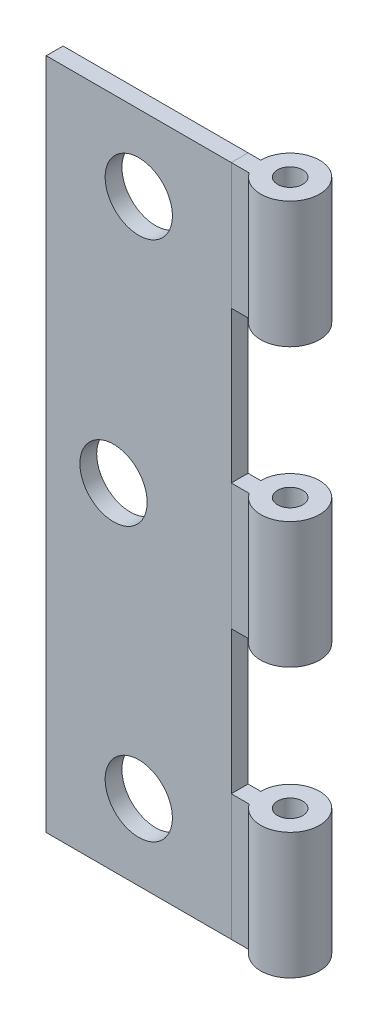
SolidWorks part; units mm, degrees
ref_plane "Front Plane" through (0, 0, 0) normal (0, 0, 1) x (1, 0, 0)
ref_plane "Top Plane" through (0, 0, 0) normal (0, 1, 0) x (1, 0, 0)
ref_plane "Right Plane" through (0, 0, 0) normal (1, 0, 0) x (0, 0, -1)
sketch "Sketch1" plane through (0, 0, 0) normal (0, 0, 1) x (1, 0, 0)
  line L1 (-8.7312, -31.75) -> (8.7313, -31.75)
  line L2 (-8.7312, -31.75) -> (-8.7312, 31.75)
  line L3 (-8.7312, 31.75) -> (8.7313, 31.75)
  line L4 (8.7313, -31.75) -> (8.7313, 31.75)
  line L5 (-8.7312, -31.75) -> (8.7313, 31.75) construction
  line L6 (-8.7312, 31.75) -> (8.7313, -31.75) construction
  point P0 (0, 0)
  dimension "D1" = 17.4625
  dimension "D2" = 63.5
extrude "Boss-Extrude1" add sketch "Sketch1" against normal blind 1.5875
sketch "Sketch3" plane through (0, 31.75, 0) normal (0, 1, 0) x (1, 0, 0)
  line L0 (-8.7312, 1.5875) -> (8.7313, 1.5875) construction
  line L1 (8.7313, 0.7937) -> (24.4766, 0.7937) construction
  line L2 (8.7313, 0) -> (-8.7312, 0) construction
  line L4 (8.7313, 1.5875) -> (10.4201, 1.5875)
  line L5 (8.7313, 1.5875) -> (8.7313, 0)
  line L6 (8.7313, 0) -> (10.4201, 0)
  line L7 (10.4201, 1.5875) -> (10.4201, 0)
  circle A0 centre (12.7, 1.5875) radius 1.1906
  circle A1 centre (12.7, 1.5875) radius 2.7781
  dimension "D1" = 2.3813
  dimension "D2" = 5.5562
  dimension "D3" = 3.9688
extrude "Boss-Extrude2" add sketch "Sketch3" against normal up to surface (63.5 mm away) separate body contours L7 L1 A0 A1 L4 | L1 L7 A1 A0
sketch "Sketch4" plane through (0, 0, -1.5875) normal (0, 0, -1) x (-1, 0, 0)
  line L0 (2.3812, 31.75) -> (2.3813, -31.75) construction
  line L1 (-8.7313, 31.75) -> (8.7312, 31.75) construction
  line L2 (8.7312, -31.75) -> (-8.7313, -31.75) construction
  line L3 (0, -31.75) -> (0, 31.75) construction
  line L4 (8.7312, 31.75) -> (8.7312, -31.75) construction
  circle A0 centre (0, 24.6062) radius 3.175
  circle A1 centre (2.3812, 0) radius 3.175
  circle A2 centre (0, -24.6063) radius 3.175
  dimension "D1" = 6.35
  dimension "D2" = 6.35
  dimension "D3" = 8.7312
  dimension "D4" = 7.1437
  dimension "D5" = 7.1437
extrude "Cut-Extrude1" cut sketch "Sketch4" against normal through all
sketch "Sketch5" plane through (0, 0, -1.5875) normal (0, 0, -1) x (-1, 0, 0)
  line L0 (-8.7313, -31.75) -> (-8.7313, 31.75) construction
  line L1 (-8.7313, 19.05) -> (-15.4781, 19.05)
  line L2 (-8.7313, 19.05) -> (-8.7313, 7.1437)
  line L3 (-8.7313, 7.1437) -> (-15.4781, 7.1437)
  line L4 (-15.4781, 19.05) -> (-15.4781, 7.1437)
  line L5 (-15.4781, 31.75) -> (-15.4781, -31.75) construction
  line L6 (-8.7313, -31.75) -> (-8.7313, 31.75) construction
  line L7 (-8.7313, -7.1438) -> (-15.4781, -7.1438)
  line L8 (-8.7313, -7.1438) -> (-8.7313, -19.05)
  line L9 (-8.7313, -19.05) -> (-15.4781, -19.05)
  line L10 (-15.4781, -7.1438) -> (-15.4781, -19.05)
  line L11 (-15.4781, 19.8437) -> (-15.4781, 19.05)
  line L12 (-8.7313, 31.75) -> (-15.4781, 31.75)
  line L13 (-8.7313, 31.75) -> (-8.7313, 19.8437)
  line L14 (-8.7313, 19.8437) -> (-15.4781, 19.8437)
  line L15 (-15.4781, 31.75) -> (-15.4781, 19.8437)
  line L16 (-15.4781, 5.5562) -> (-8.7313, 5.5562)
  line L17 (-15.4781, 5.5562) -> (-15.4781, -6.35)
  line L18 (-15.4781, -6.35) -> (-8.7313, -6.35)
  line L19 (-8.7313, 5.5562) -> (-8.7313, -6.35)
  line L20 (-8.7313, -19.8438) -> (-15.4781, -19.8438)
  line L21 (-8.7313, -19.8438) -> (-8.7313, -31.75)
  line L22 (-8.7313, -31.75) -> (-15.4781, -31.75)
  line L23 (-15.4781, -19.8438) -> (-15.4781, -31.75)
  line L24 (-8.7313, 19.05) -> (-8.7313, 19.8437)
  line L25 (-8.7313, 7.1437) -> (-8.7313, 5.5562)
  line L26 (-15.4781, 5.5562) -> (-15.4781, 7.1437)
  line L27 (-15.4781, -6.35) -> (-15.4781, -7.1438)
  line L28 (-8.7313, -7.1438) -> (-8.7313, -6.35)
  line L29 (-8.7313, -19.05) -> (-8.7313, -19.8438)
  line L30 (-15.4781, -19.8438) -> (-15.4781, -19.05)
  dimension "D1" = 11.9062
  dimension "D2" = 11.9062
  dimension "D3" = 11.9062
  dimension "D4" = 11.9062
  dimension "D5" = 11.9062
  dimension "D6" = 0.7937
  dimension "D7" = 0.7937
  dimension "D8" = 0.7937
  dimension "D9" = 1.5875
extrude "Cut-Extrude3" cut sketch "Sketch5" against normal through all both and the other way through all contours L14 L11 L1 M17 | L26 L16 L3 M17 | L30 L20 L9 M17 | L18 L27 L7 M17 | L1 L4 L3 M17 | L7 L10 L9 M17
